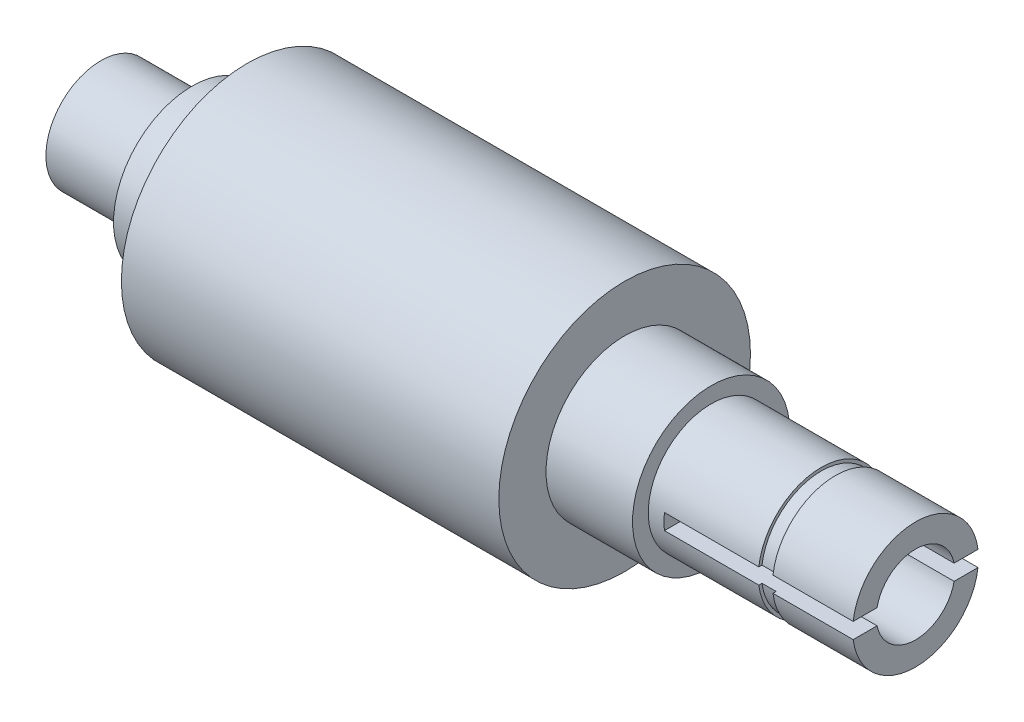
SolidWorks part; units mm, degrees
ref_plane "Face" through (0, 0, 0) normal (0, 0, 1) x (1, 0, 0)
ref_plane "Dessus" through (0, 0, 0) normal (0, 1, 0) x (1, 0, 0)
ref_plane "Droite" through (0, 0, 0) normal (1, 0, 0) x (0, 0, -1)
sketch "Esquisse1" plane through (0, 0, 0) normal (0, 0, 1) x (1, 0, 0)
  line L0 (0, 0) -> (-66.691, 0) construction
  line L1 (0, 2.5) -> (0, 4)
  line L2 (-18.5, 5) -> (-13, 5)
  line L3 (-18.5, 5) -> (-18.5, 8)
  line L4 (-18.5, 8) -> (-42.5, 8)
  line L5 (-42.5, 8) -> (-42.5, 5)
  line L6 (-42.5, 5) -> (-46, 5)
  line L7 (0, 2.5) -> (-15, 2.5)
  line L8 (-51.8, 3.5) -> (-51.8, 0)
  line L9 (-15, 2.5) -> (-16.4434, 0)
  line L10 (-16.4434, 0) -> (-51.8, 0)
  line L11 (-13, 5) -> (-13, 4)
  line L12 (-13, 4) -> (0, 4)
  line L13 (-46, 5) -> (-46, 3.5)
  line L14 (-46, 3.5) -> (-51.8, 3.5)
  dimension "D1" = 5
  dimension "D2" = 18.5
  dimension "D3" = 16
  dimension "D4" = 5.8
  dimension "D5" = 24
  dimension "D6" = 3.5
  dimension "D7" = 15
  dimension "D8" = 120
  dimension "D9" = 7
  dimension "D10" = 10
  dimension "D11" = 5.5
  dimension "D12" = 8
  dimension "D13" = 10
revolve "Révolution1" add sketch "Esquisse1" angle 360 about L0
sketch "Esquisse2" plane through (0, 0, 0) normal (0, 0, 1) x (1, 0, 0)
  line L1 (-12, -0.5) -> (0, -0.5)
  line L2 (-12, -0.5) -> (-12, 0.5)
  line L3 (-12, 0.5) -> (0, 0.5)
  line L4 (0, -0.5) -> (0, 0.5)
  line L6 (0, -4) -> (0, 4) construction
  dimension "D1" = 12
  dimension "D2" = 0.5
  dimension "D3" = 0.5
extrude "Enlèv. mat.-Extru.1" cut sketch "Esquisse2" against normal mid plane 20
hole_wizard "Trou taraudé M5x0.81" positions "Esquisse4" profile "Esquisse3" tap size "M5x0.8" standard "DIN"
sketch "Esquisse4" plane through (-51.8, 0, 0) normal (-1, 0, 0) x (0, 0, 1)
  point P0 (0, 0)
sketch "Esquisse3" plane through (-51.8, 0, 0) normal (0, 1, 0) x (0, 0, 1)
  line L0 (0, 0) -> (0, 13.6124)
  line L1 (0, 13.6124) -> (2.1, 12.4)
  line L2 (2.1, 12.4) -> (2.1, 0.4)
  line L3 (2.1, 0.4) -> (2.5, 0)
  line L5 (2.5, 0) -> (0, 0)
  line L6 (-2.1, 0.4) -> (-2.5, 0) construction
  line L10 (0, 13.6124) -> (-2.1, 12.4) construction
  line L11 (0, -6.35) -> (0, 107.95) construction
  dimension "Diamètre du trou pour taraudage" = 4.2
  dimension "Profondeur du trou pour taraudage" = 12.4
  dimension "Diamètre du fraisage entrant" = 5
  dimension "Angle du fraisage entrant" = 90
  dimension "Angle de pointe" = 120
ref_plane "Plan1" through (0, -4, 0) normal (0, 1, 0) x (-1, 0, 0)
ref_plane "Plan2" through (-6, 0, 0) normal (1, 0, 0) x (0, 0, -1)
sketch "Esquisse5" plane through (-6, 0, 0) normal (1, 0, 0) x (0, 0, -1)
  circle A0 centre (0, 0) radius 4
  arc A1 (3.9686, 0.5) -> (-3.9686, 0.5) centre (0, 0) ccw construction
  circle A2 centre (0, 0) radius 3.8
  dimension "D1" = 7.6
extrude "Enlèv. mat.-Extru.2" cut sketch "Esquisse5" along normal blind 0.9
